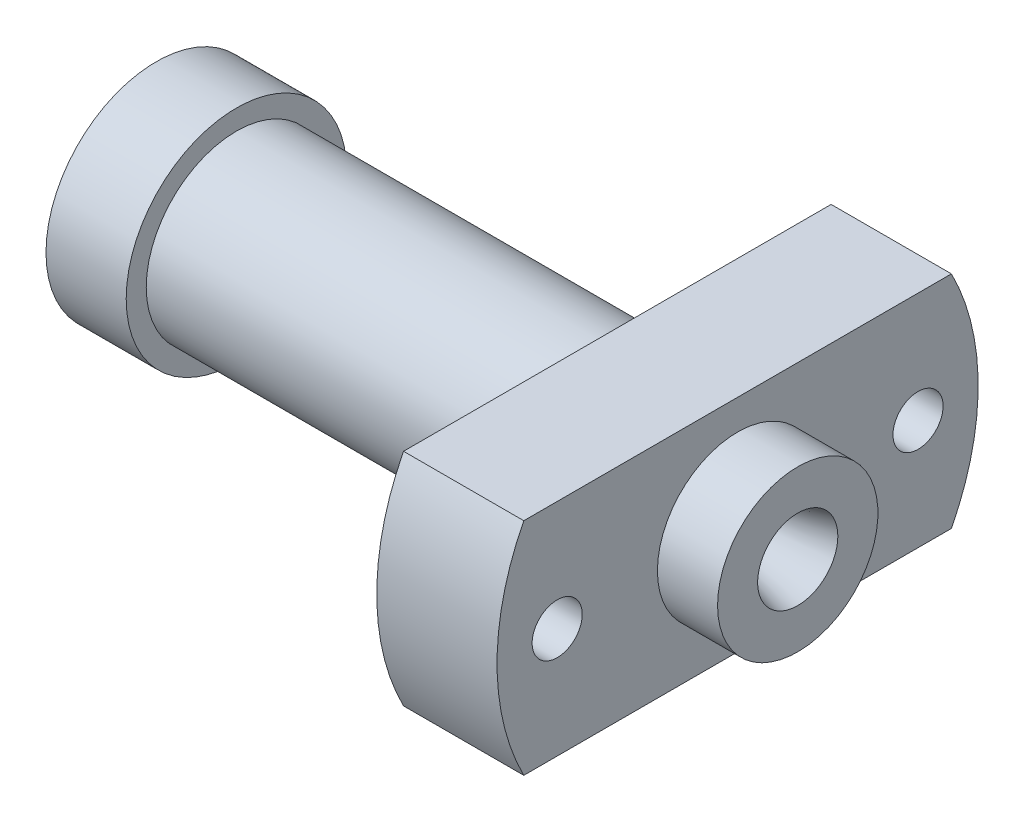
SolidWorks part; units mm, degrees
ref_plane "Front Plane" through (0, 0, 0) normal (0, 0, 1) x (1, 0, 0)
ref_plane "Top Plane" through (0, 0, 0) normal (0, 1, 0) x (1, 0, 0)
ref_plane "Right Plane" through (0, 0, 0) normal (1, 0, 0) x (0, 0, -1)
sketch "Sketch1" plane through (0, 0, 0) normal (0, 0, 1) x (1, 0, 0)
  line L0 (0, 2.75) -> (0, 2)
  line L1 (0, 2) -> (2.3083, 1.25)
  line L2 (2.3083, 1.25) -> (11.7502, 1.25)
  line L3 (11.7502, 1.25) -> (12.4412, 0.1)
  line L4 (12.6412, 0.1) -> (16, 1)
  line L5 (16, 1) -> (16, 2)
  line L6 (16, 2) -> (14.5, 2)
  line L7 (14.5, 2) -> (14.5, 6)
  line L8 (14.5, 6) -> (11.5, 6)
  line L9 (11.5, 6) -> (11.5, 2.25)
  line L10 (11.5, 2.25) -> (2, 2.25)
  line L11 (2, 2.25) -> (2, 2.75)
  line L12 (2, 2.75) -> (0, 2.75)
  line L13 (-6.06, 0) -> (21.1899, 0) construction
  line L14 (12.4412, 0.1) -> (12.6412, 0.1)
  dimension "D1" = 2.75
  dimension "D2" = 2
  dimension "D3" = 1.25
  dimension "D4" = 2.25
  dimension "D5" = 18
  dimension "D6" = 2
  dimension "D7" = 11.5
  dimension "D8" = 1.5
  dimension "D9" = 16
  dimension "D10" = 1
  dimension "D11" = 0.1
  dimension "D12" = 2.3083
  dimension "D13" = 15
  dimension "D14" = 59
  dimension "D15" = 0.891
  dimension "D16" = 0.2
  dimension "D17" = 2
  dimension "D18" = 3.3588
  dimension "D19" = 6
revolve "Revolve1" add sketch "Sketch1" angle 360 about L13
sketch "Sketch2" plane through (14.5, 0, 0) normal (1, 0, 0) x (0, 0, -1)
  line L0 (-5.3327, 2.75) -> (5.3327, 2.75)
  line L1 (-5.3327, -2.75) -> (5.3327, -2.75)
  arc A0 (-5.3327, -2.75) -> (5.3327, -2.75) centre (0, 0) ccw
  arc A1 (5.3327, 2.75) -> (-5.3327, 2.75) centre (0, 0) ccw
  dimension "D3" = 6
  dimension "D1" = 5.5
  dimension "D2" = 2.75
extrude "Cut-Extrude1" cut sketch "Sketch2" against normal blind 4
hole_wizard "M1.6 Tapped Hole2" positions "Sketch4" profile "Sketch3" tap size "M1.6" standard "ISO"
sketch "Sketch4" plane through (14.5, 0, 0) normal (1, 0, 0) x (0, 0, -1)
  point P0 (-4.5, 0)
  point P2 (4.5, 0)
  dimension "D1" = 4.5
  dimension "D2" = 4.5
sketch "Sketch3" plane through (14.5, 0, 4.5) normal (0, 1, 0) x (0, 0, -1)
  line L0 (0, 0) -> (0, 4.3755)
  line L1 (0, 4.3755) -> (0.625, 4)
  line L2 (0.625, 4) -> (0.625, 0)
  line L5 (0.625, 0) -> (0, 0)
  line L10 (0, 4.3755) -> (-0.625, 4) construction
  line L11 (0, -6.35) -> (0, 107.95) construction
  dimension "Tap Drill Dia." = 1.25
  dimension "Tap Drill Depth" = 4
  dimension "Drill Angle" = 118
